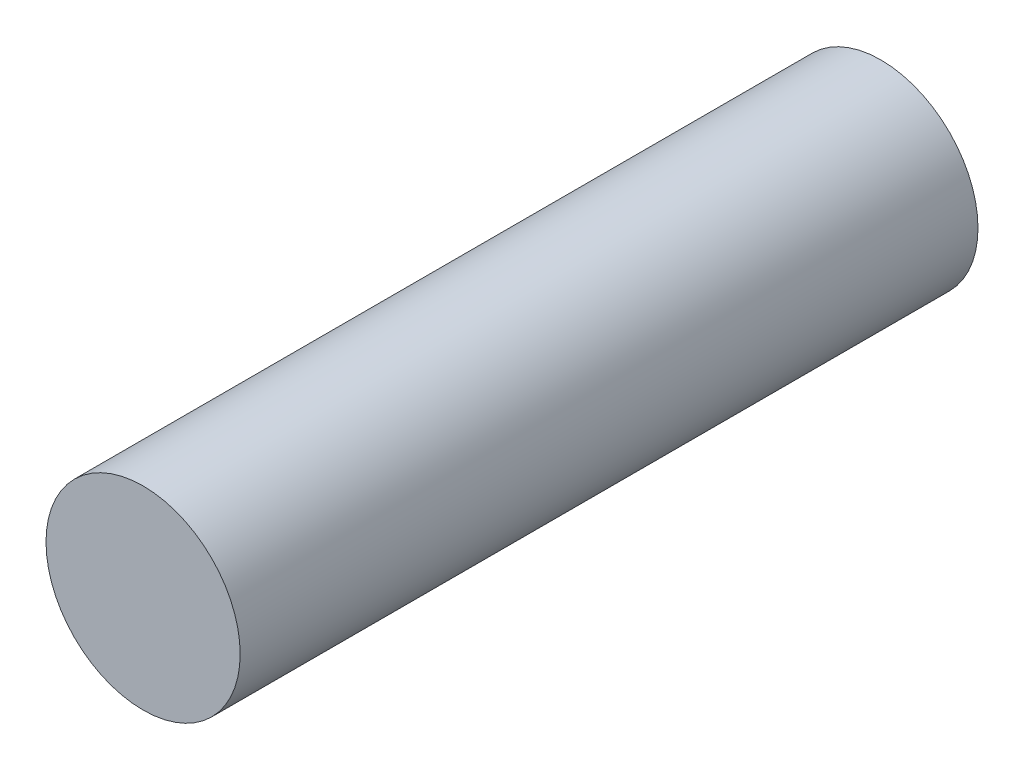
SolidWorks part; units mm, degrees
ref_plane "Plan de face" through (0, 0, 0) normal (0, 0, 1) x (1, 0, 0)
ref_plane "Plan de dessus" through (0, 0, 0) normal (0, 1, 0) x (1, 0, 0)
ref_plane "Plan de droite" through (0, 0, 0) normal (1, 0, 0) x (0, 0, -1)
sketch "Esquisse1" plane through (0, 0, 0) normal (0, 0, 1) x (1, 0, 0)
  circle A0 centre (0, 0) radius 12.5
extrude "Extrusion1" add sketch "Esquisse1" along normal blind 95
